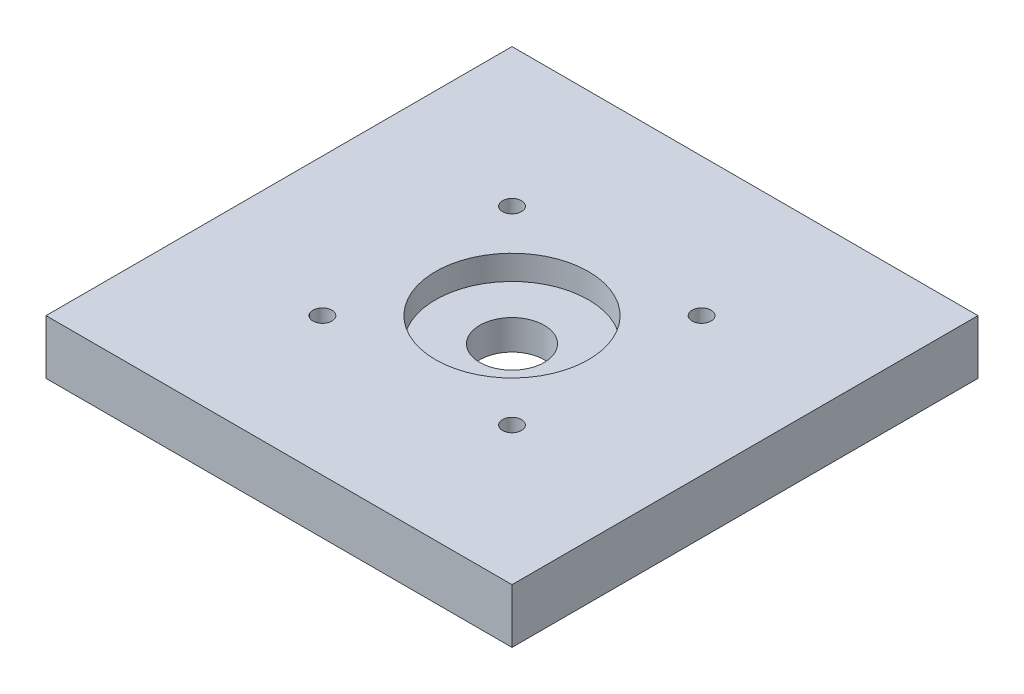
SolidWorks part; units mm, degrees
ref_plane "Front Plane" through (0, 0, 0) normal (0, 0, 1) x (1, 0, 0)
ref_plane "Top Plane" through (0, 0, 0) normal (0, 1, 0) x (1, 0, 0)
ref_plane "Right Plane" through (0, 0, 0) normal (1, 0, 0) x (0, 0, -1)
sketch "Sketch1" plane through (0, 0, 0) normal (0, 1, 0) x (1, 0, 0)
  line L5 (-38.1, 38.1) -> (38.1, 38.1)
  line L6 (-38.1, 38.1) -> (-38.1, -38.1)
  line L7 (-38.1, -38.1) -> (38.1, -38.1)
  line L8 (38.1, 38.1) -> (38.1, -38.1)
  line L9 (-38.1, 38.1) -> (38.1, -38.1) construction
  line L10 (-38.1, -38.1) -> (38.1, 38.1) construction
  circle A0 centre (-15.5, -15.5) radius 1.55
  circle A1 centre (15.5, -15.5) radius 1.55
  circle A2 centre (15.5, 15.5) radius 1.55
  circle A3 centre (-15.5, 15.5) radius 1.55
  circle A4 centre (-1.3312, 1.3512) radius 0.0101
  circle A7 centre (0, 0) radius 5.2705
  point P0 (0, 0)
  point P14 (0, 0)
  dimension "D4" = 3.1
  dimension "D5" = 10.541
  dimension "D1" = 76.2
  dimension "D2" = 76.2
  dimension "D3" = 31
extrude "Boss-Extrude1" add sketch "Sketch1" along normal blind 8.89 contours L8 L5 L6 L7 A7 A3 A2 A1 A0
sketch "Sketch2" plane through (0, 8.89, 0) normal (0, 1, 0) x (1, 0, 0)
  circle A0 centre (0, 0) radius 12.5
  dimension "D1" = 25
extrude "Cut-Extrude1" cut sketch "Sketch2" against normal blind 4
